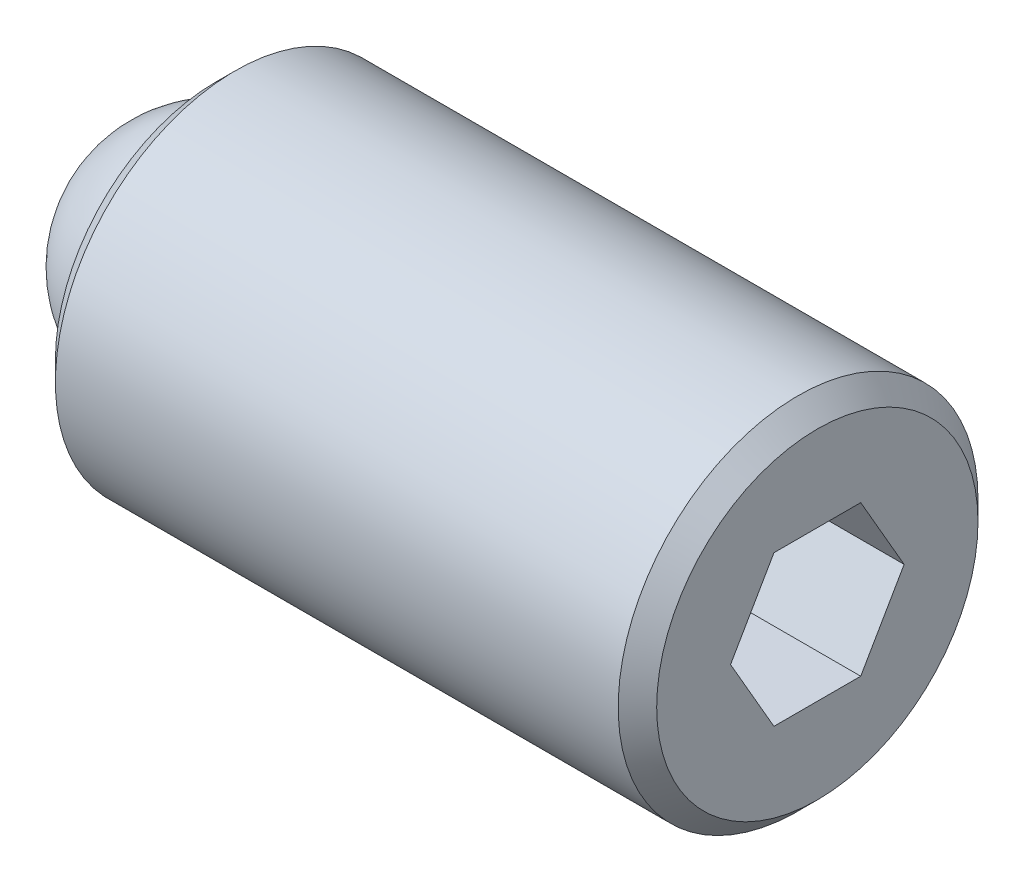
SolidWorks part; units mm, degrees
ref_plane "Front Plane" through (0, 0, 0) normal (0, 0, 1) x (1, 0, 0)
ref_plane "Top Plane" through (0, 0, 0) normal (0, 1, 0) x (1, 0, 0)
ref_plane "Right Plane" through (0, 0, 0) normal (1, 0, 0) x (0, 0, -1)
sketch "Sketch2" plane through (0, 0, 0) normal (1, 0, 0) x (0, 0, -1)
  circle A0 centre (0, 0) radius 2.3749
  dimension "D1" = 4.7498
extrude "Boss-Extrude1" add sketch "Sketch2" along normal blind 7.9375
sketch "Sketch3" plane through (0, 0, 0) normal (-1, 0, 0) x (0, 0, 1)
  circle A0 centre (0, 0) radius 1.5875
  dimension "D1" = 3.175
chamfer "Chamfer1" distance 0.254 angle 45 1 edges at (0, 0, -2.3749)
chamfer "Chamfer2" distance 0.254 angle 45 1 edges at (7.9375, 0, -2.3749)
sketch "Sketch4" plane through (7.9375, 0, 0) normal (1, 0, 0) x (0, 0, -1)
  line L1 (1.1457, 0) -> (0.5728, 0.9922)
  line L2 (0.5728, 0.9922) -> (-0.5728, 0.9922)
  line L3 (-0.5728, 0.9922) -> (-1.1457, 0)
  line L4 (-1.1457, 0) -> (-0.5728, -0.9922)
  line L5 (-0.5728, -0.9922) -> (0.5728, -0.9922)
  line L6 (0.5728, -0.9922) -> (1.1457, 0)
  circle A0 centre (0, 0) radius 0.9922 construction
extrude "Cut-Extrude2" cut sketch "Sketch4" against normal blind 2.286
extrude "Cut-Extrude3" cut sketch "Sketch3" against normal blind 1.5875
sketch "Sketch5" plane through (0, 0, 0) normal (-1, 0, 0) x (0, 0, 1)
  line L0 (0, 0) -> (0, -1.5875)
  line L1 (0, 0) -> (0, 1.5875)
  arc A0 (0, 1.5875) -> (0, -1.5875) centre (0, 0) ccw
revolve "Revolve1" add sketch "Sketch5" angle 360 about L1
